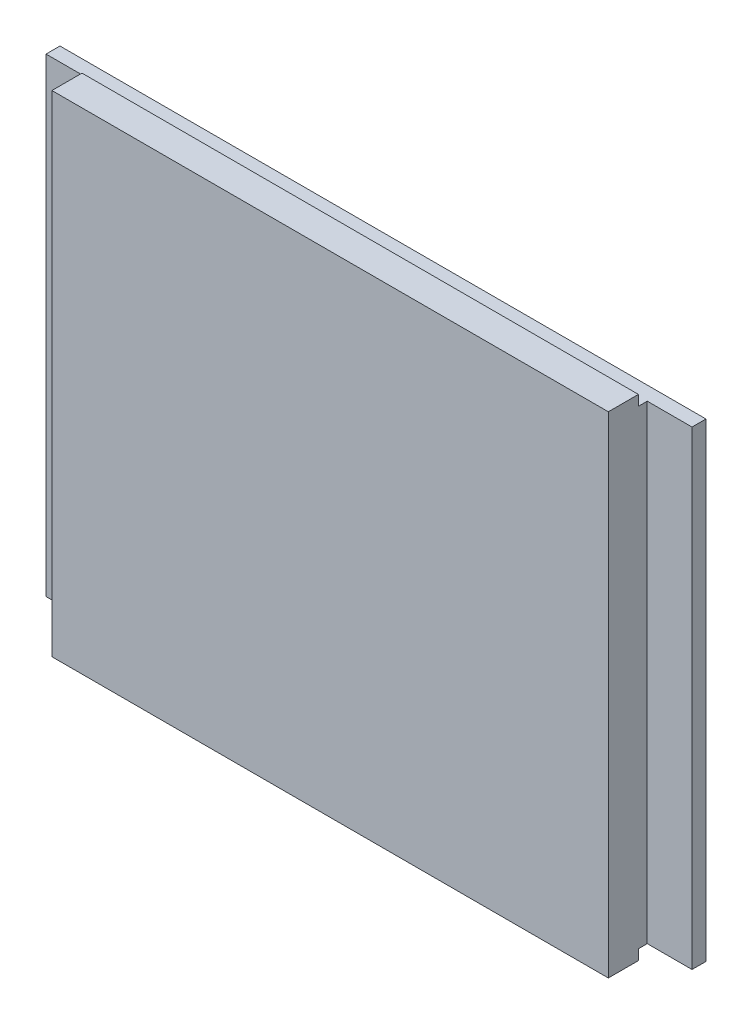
SolidWorks part; units mm, degrees
ref_plane "Front Plane" through (0, 0, 0) normal (0, 0, 1) x (1, 0, 0)
ref_plane "Top Plane" through (0, 0, 0) normal (0, 1, 0) x (1, 0, 0)
ref_plane "Right Plane" through (0, 0, 0) normal (1, 0, 0) x (0, 0, -1)
sketch "Esquisse1" plane through (0, 0, 0) normal (0, 0, 1) x (1, 0, 0)
  line L1 (-110, -80) -> (110, -80)
  line L2 (-110, -80) -> (-110, 80)
  line L3 (-110, 80) -> (110, 80)
  line L4 (110, -80) -> (110, 80)
  line L5 (-110, -80) -> (110, 80) construction
  line L6 (-110, 80) -> (110, -80) construction
  point P0 (0, 0)
  dimension "D1" = 220
  dimension "D2" = 160
extrude "Boss.-Extru.1" add sketch "Esquisse1" along normal blind 18
sketch "Esquisse4" plane through (0, 0, 18) normal (0, 0, 1) x (1, 0, 0)
  line L0 (110, -80) -> (110, 80) construction
  line L1 (-110, 80) -> (-110, -80) construction
  line L2 (110, -80) -> (110, 80)
  line L3 (-110, 80) -> (-110, -80)
  line L4 (-94.75, 80) -> (-94.75, -80)
  line L5 (94.75, -80) -> (94.75, 80)
  line L6 (-110, -80) -> (110, -80) construction
  line L7 (110, 80) -> (-110, 80) construction
  line L8 (-110, -80) -> (110, -80)
  line L9 (110, 80) -> (-110, 80)
  dimension "D1" = 15.25
extrude "Enlèv. mat.-Extru.1" cut sketch "Esquisse4" against normal blind 13.25 contours L4 M6 M7 M8 | L5 M8 M5 M6
sketch "Esquisse5" plane through (0, 80, 0) normal (0, 1, 0) x (1, 0, 0)
  line L0 (-94.75, -7.75) -> (94.75, -7.75)
  line L8 (-94.75, -4.75) -> (-94.75, -18)
  line L9 (-94.75, -18) -> (94.75, -18)
  line L10 (94.75, -18) -> (94.75, -4.75)
  line L11 (94.75, -4.75) -> (110, -4.75)
  line L12 (110, -4.75) -> (110, 0)
  line L13 (110, 0) -> (-110, 0)
  line L14 (-110, 0) -> (-110, -4.75)
  line L15 (-110, -4.75) -> (-94.75, -4.75)
  line L16 (-94.75, -4.75) -> (-94.75, -18)
  line L17 (-94.75, -18) -> (94.75, -18)
  line L18 (94.75, -18) -> (94.75, -4.75)
  line L19 (94.75, -4.75) -> (110, -4.75)
  line L20 (110, -4.75) -> (110, 0)
  line L21 (110, 0) -> (-110, 0)
  line L22 (-110, 0) -> (-110, -4.75)
  line L23 (-110, -4.75) -> (-94.75, -4.75)
  dimension "D2" = 10.25
  dimension "D1" = 0
extrude "Boss.-Extru.3" add sketch "Esquisse5" along normal blind 3.5 and the other way blind 163.5 contours L0 M9 M10 M11
